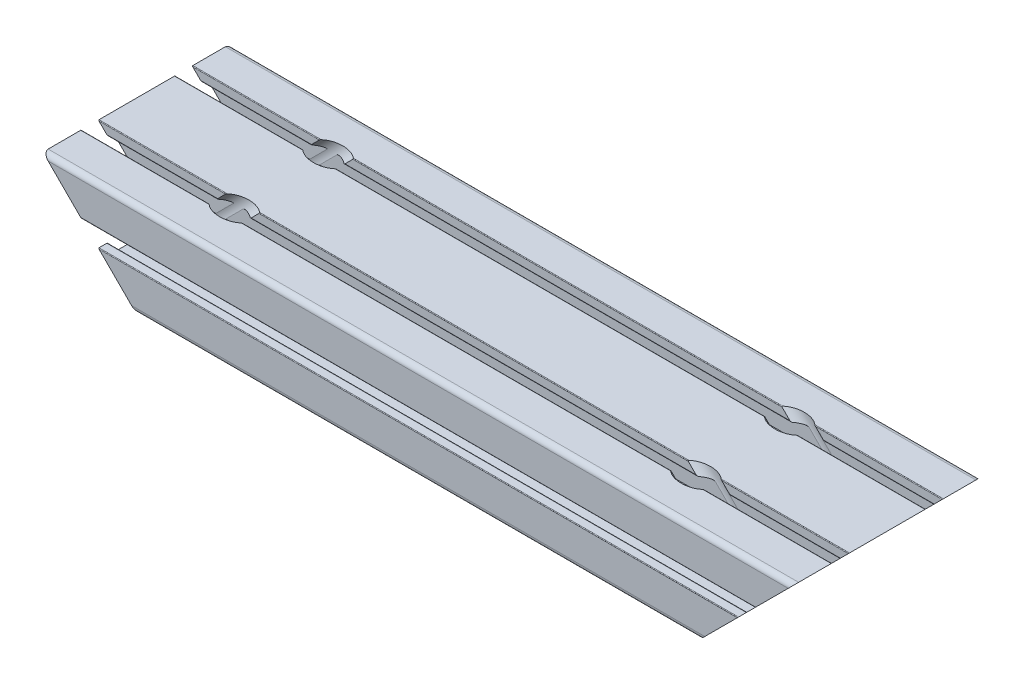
SolidWorks part; units mm, degrees
ref_plane "Front Plane" through (0, 0, 0) normal (0, 0, 1) x (1, 0, 0)
ref_plane "Top Plane" through (0, 0, 0) normal (0, 1, 0) x (1, 0, 0)
ref_plane "Right Plane" through (0, 0, 0) normal (1, 0, 0) x (0, 0, -1)
sketch3d "3DSketch2"
  line L0 (195, 0, 0) -> (-165, 0, 0)
  dimension "D1" = 360
  dimension "D2" = 195
other "45-sarja 1.0036 45X90(1)"
ref_plane "Plane1" through (195, 0, 0) normal (-1, 0, 0) x (0, 1, 0)
sketch "Model" plane through (195, 0, 0) normal (-1, 0, 0) x (0, 1, 0)
  line L0 (4.3841, 25.8941) -> (3.3941, 26.8841)
  line L1 (2.9698, 26.8841) -> (1.9491, 25.8633)
  line L2 (-1.9491, 25.8633) -> (-2.9698, 26.8841)
  line L3 (-3.3941, 26.8841) -> (-4.3841, 25.8941)
  line L4 (-4.3841, 25.4698) -> (-3.3633, 24.4491)
  line L5 (-3.3633, 20.5509) -> (-4.3841, 19.5302)
  line L6 (-4.3841, 19.1059) -> (-3.3941, 18.1159)
  line L7 (-2.9698, 18.1159) -> (-1.9491, 19.1367)
  line L8 (1.9491, 19.1367) -> (2.9698, 18.1159)
  line L9 (3.3941, 18.1159) -> (4.3841, 19.1059)
  line L10 (4.3841, 19.5302) -> (3.3633, 20.5509)
  line L11 (3.3633, 24.4491) -> (4.3841, 25.4698)
  line L12 (-19.5, 12.5) -> (-19.5, -12.5)
  line L13 (-18.5, -13.5) -> (18.5, -13.5)
  line L14 (19.5, -12.5) -> (19.5, 12.5)
  line L15 (18.5, 13.5) -> (-18.5, 13.5)
  line L16 (3.3633, -20.5509) -> (4.3841, -19.5302)
  line L17 (4.3841, -19.1059) -> (3.3941, -18.1159)
  line L18 (2.9698, -18.1159) -> (1.9491, -19.1367)
  line L19 (-1.9491, -19.1367) -> (-2.9698, -18.1159)
  line L20 (-3.3941, -18.1159) -> (-4.3841, -19.1059)
  line L21 (-4.3841, -19.5302) -> (-3.3633, -20.5509)
  line L22 (-3.3633, -24.4491) -> (-4.3841, -25.4698)
  line L23 (-4.3841, -25.8941) -> (-3.3941, -26.8841)
  line L24 (-2.9698, -26.8841) -> (-1.9491, -25.8633)
  line L25 (1.9491, -25.8633) -> (2.9698, -26.8841)
  line L26 (3.3941, -26.8841) -> (4.3841, -25.8941)
  line L27 (4.3841, -25.4698) -> (3.3633, -24.4491)
  line L28 (4.4, -45) -> (20, -45)
  line L29 (4.1, -41) -> (4.1, -44.7)
  line L30 (6.5, -40.5) -> (4.6, -40.5)
  line L31 (6.8, -31.7) -> (6.8, -40.2)
  line L32 (4.8, -29.7) -> (6.8, -31.7)
  line L33 (-4.8, -29.7) -> (4.8, -29.7)
  line L34 (-6.8, -31.7) -> (-4.8, -29.7)
  line L35 (-6.8, -40.2) -> (-6.8, -31.7)
  line L36 (-4.6, -40.5) -> (-6.5, -40.5)
  line L37 (-4.1, -44.7) -> (-4.1, -41)
  line L38 (-20, -45) -> (-4.4, -45)
  line L39 (-22.5, -26.9) -> (-22.5, -42.5)
  line L40 (-18.5, -26.6) -> (-22.2, -26.6)
  line L41 (-18, -29) -> (-18, -27.1)
  line L42 (-9.2, -29.3) -> (-17.7, -29.3)
  line L43 (-7.2, -27.3) -> (-9.2, -29.3)
  line L44 (-7.2, -17.7) -> (-7.2, -27.3)
  line L45 (-9.2, -15.7) -> (-7.2, -17.7)
  line L46 (-17.7, -15.7) -> (-9.2, -15.7)
  line L47 (-18, -17.9) -> (-18, -16)
  line L48 (-22.2, -18.4) -> (-18.5, -18.4)
  line L49 (-22.5, 18.1) -> (-22.5, -18.1)
  line L50 (-18.5, 18.4) -> (-22.2, 18.4)
  line L51 (-18, 16) -> (-18, 17.9)
  line L52 (-9.2, 15.7) -> (-17.7, 15.7)
  line L53 (-7.2, 17.7) -> (-9.2, 15.7)
  line L54 (-7.2, 27.3) -> (-7.2, 17.7)
  line L55 (-9.2, 29.3) -> (-7.2, 27.3)
  line L56 (-17.7, 29.3) -> (-9.2, 29.3)
  line L57 (-18, 27.1) -> (-18, 29)
  line L58 (-22.2, 26.6) -> (-18.5, 26.6)
  line L59 (-22.5, 42.5) -> (-22.5, 26.9)
  line L60 (-4.4, 45) -> (-20, 45)
  line L61 (-4.1, 41) -> (-4.1, 44.7)
  line L62 (-6.5, 40.5) -> (-4.6, 40.5)
  line L63 (-6.8, 31.7) -> (-6.8, 40.2)
  line L64 (-4.8, 29.7) -> (-6.8, 31.7)
  line L65 (4.8, 29.7) -> (-4.8, 29.7)
  line L66 (6.8, 31.7) -> (4.8, 29.7)
  line L67 (6.8, 40.2) -> (6.8, 31.7)
  line L68 (4.6, 40.5) -> (6.5, 40.5)
  line L69 (4.1, 44.7) -> (4.1, 41)
  line L70 (20, 45) -> (4.4, 45)
  line L71 (22.5, 26.9) -> (22.5, 42.5)
  line L72 (18.5, 26.6) -> (22.2, 26.6)
  line L73 (18, 29) -> (18, 27.1)
  line L74 (9.2, 29.3) -> (17.7, 29.3)
  line L75 (7.2, 27.3) -> (9.2, 29.3)
  line L76 (7.2, 17.7) -> (7.2, 27.3)
  line L77 (9.2, 15.7) -> (7.2, 17.7)
  line L78 (17.7, 15.7) -> (9.2, 15.7)
  line L79 (18, 17.9) -> (18, 16)
  line L80 (22.2, 18.4) -> (18.5, 18.4)
  line L81 (22.5, -18.1) -> (22.5, 18.1)
  line L82 (18.5, -18.4) -> (22.2, -18.4)
  line L83 (18, -16) -> (18, -17.9)
  line L84 (9.2, -15.7) -> (17.7, -15.7)
  line L85 (7.2, -17.7) -> (9.2, -15.7)
  line L86 (7.2, -27.3) -> (7.2, -17.7)
  line L87 (9.2, -29.3) -> (7.2, -27.3)
  line L88 (17.7, -29.3) -> (9.2, -29.3)
  line L89 (18, -27.1) -> (18, -29)
  line L90 (22.2, -26.6) -> (18.5, -26.6)
  line L91 (22.5, -42.5) -> (22.5, -26.9)
  circle A0 centre (14.65, 37.15) radius 5.85
  arc A1 (4.3841, 25.4698) -> (4.3841, 25.8941) centre (4.1719, 25.682) ccw
  arc A2 (3.3941, 26.8841) -> (2.9698, 26.8841) centre (3.182, 26.6719) ccw
  arc A3 (1.6059, 25.8056) -> (1.9491, 25.8633) centre (1.7369, 26.0754) ccw
  arc A4 (1.6059, 25.8056) -> (-1.6059, 25.8056) centre (0, 22.5) ccw
  arc A5 (-1.9491, 25.8633) -> (-1.6059, 25.8056) centre (-1.7369, 26.0754) ccw
  arc A6 (-2.9698, 26.8841) -> (-3.3941, 26.8841) centre (-3.182, 26.6719) ccw
  arc A7 (-4.3841, 25.8941) -> (-4.3841, 25.4698) centre (-4.1719, 25.682) ccw
  arc A8 (-3.3056, 24.1059) -> (-3.3633, 24.4491) centre (-3.5754, 24.2369) ccw
  arc A9 (-3.3056, 24.1059) -> (-3.3056, 20.8941) centre (0, 22.5) ccw
  arc A10 (-3.3633, 20.5509) -> (-3.3056, 20.8941) centre (-3.5754, 20.7631) ccw
  arc A11 (-4.3841, 19.5302) -> (-4.3841, 19.1059) centre (-4.1719, 19.318) ccw
  arc A12 (-3.3941, 18.1159) -> (-2.9698, 18.1159) centre (-3.182, 18.3281) ccw
  arc A13 (-1.6059, 19.1944) -> (-1.9491, 19.1367) centre (-1.7369, 18.9246) ccw
  arc A14 (-1.6059, 19.1944) -> (1.6059, 19.1944) centre (0, 22.5) ccw
  arc A15 (1.9491, 19.1367) -> (1.6059, 19.1944) centre (1.7369, 18.9246) ccw
  arc A16 (2.9698, 18.1159) -> (3.3941, 18.1159) centre (3.182, 18.3281) ccw
  arc A17 (4.3841, 19.1059) -> (4.3841, 19.5302) centre (4.1719, 19.318) ccw
  arc A18 (3.3056, 20.8941) -> (3.3633, 20.5509) centre (3.5754, 20.7631) ccw
  arc A19 (3.3056, 20.8941) -> (3.3056, 24.1059) centre (0, 22.5) ccw
  arc A20 (3.3633, 24.4491) -> (3.3056, 24.1059) centre (3.5754, 24.2369) ccw
  arc A21 (-18.5, 13.5) -> (-19.5, 12.5) centre (-18.5, 12.5) ccw
  arc A22 (-19.5, -12.5) -> (-18.5, -13.5) centre (-18.5, -12.5) ccw
  arc A23 (18.5, -13.5) -> (19.5, -12.5) centre (18.5, -12.5) ccw
  arc A24 (19.5, 12.5) -> (18.5, 13.5) centre (18.5, 12.5) ccw
  arc A25 (4.3841, -19.5302) -> (4.3841, -19.1059) centre (4.1719, -19.318) ccw
  arc A26 (3.3941, -18.1159) -> (2.9698, -18.1159) centre (3.182, -18.3281) ccw
  arc A27 (1.6059, -19.1944) -> (1.9491, -19.1367) centre (1.7369, -18.9246) ccw
  arc A28 (1.6059, -19.1944) -> (-1.6059, -19.1944) centre (0, -22.5) ccw
  arc A29 (-1.9491, -19.1367) -> (-1.6059, -19.1944) centre (-1.7369, -18.9246) ccw
  arc A30 (-2.9698, -18.1159) -> (-3.3941, -18.1159) centre (-3.182, -18.3281) ccw
  arc A31 (-4.3841, -19.1059) -> (-4.3841, -19.5302) centre (-4.1719, -19.318) ccw
  arc A32 (-3.3056, -20.8941) -> (-3.3633, -20.5509) centre (-3.5754, -20.7631) ccw
  arc A33 (-3.3056, -20.8941) -> (-3.3056, -24.1059) centre (0, -22.5) ccw
  arc A34 (-3.3633, -24.4491) -> (-3.3056, -24.1059) centre (-3.5754, -24.2369) ccw
  arc A35 (-4.3841, -25.4698) -> (-4.3841, -25.8941) centre (-4.1719, -25.682) ccw
  arc A36 (-3.3941, -26.8841) -> (-2.9698, -26.8841) centre (-3.182, -26.6719) ccw
  arc A37 (-1.6059, -25.8056) -> (-1.9491, -25.8633) centre (-1.7369, -26.0754) ccw
  arc A38 (-1.6059, -25.8056) -> (1.6059, -25.8056) centre (0, -22.5) ccw
  arc A39 (1.9491, -25.8633) -> (1.6059, -25.8056) centre (1.7369, -26.0754) ccw
  arc A40 (2.9698, -26.8841) -> (3.3941, -26.8841) centre (3.182, -26.6719) ccw
  arc A41 (4.3841, -25.8941) -> (4.3841, -25.4698) centre (4.1719, -25.682) ccw
  arc A42 (3.3056, -24.1059) -> (3.3633, -24.4491) centre (3.5754, -24.2369) ccw
  arc A43 (3.3056, -24.1059) -> (3.3056, -20.8941) centre (0, -22.5) ccw
  arc A44 (3.3633, -20.5509) -> (3.3056, -20.8941) centre (3.5754, -20.7631) ccw
  circle A45 centre (14.65, -37.15) radius 5.85
  arc A46 (4.1, -44.7) -> (4.4, -45) centre (4.4, -44.7) ccw
  arc A47 (4.6, -40.5) -> (4.1, -41) centre (4.6, -41) ccw
  arc A48 (6.5, -40.5) -> (6.8, -40.2) centre (6.5, -40.2) ccw
  arc A49 (-6.8, -40.2) -> (-6.5, -40.5) centre (-6.5, -40.2) ccw
  arc A50 (-4.1, -41) -> (-4.6, -40.5) centre (-4.6, -41) ccw
  arc A51 (-4.4, -45) -> (-4.1, -44.7) centre (-4.4, -44.7) ccw
  arc A52 (-22.5, -42.5) -> (-20, -45) centre (-20, -42.5) ccw
  arc A53 (-22.2, -26.6) -> (-22.5, -26.9) centre (-22.2, -26.9) ccw
  arc A54 (-18, -27.1) -> (-18.5, -26.6) centre (-18.5, -27.1) ccw
  arc A55 (-18, -29) -> (-17.7, -29.3) centre (-17.7, -29) ccw
  arc A56 (-17.7, -15.7) -> (-18, -16) centre (-17.7, -16) ccw
  arc A57 (-18.5, -18.4) -> (-18, -17.9) centre (-18.5, -17.9) ccw
  arc A58 (-22.5, -18.1) -> (-22.2, -18.4) centre (-22.2, -18.1) ccw
  arc A59 (-22.2, 18.4) -> (-22.5, 18.1) centre (-22.2, 18.1) ccw
  arc A60 (-18, 17.9) -> (-18.5, 18.4) centre (-18.5, 17.9) ccw
  arc A61 (-18, 16) -> (-17.7, 15.7) centre (-17.7, 16) ccw
  arc A62 (-17.7, 29.3) -> (-18, 29) centre (-17.7, 29) ccw
  arc A63 (-18.5, 26.6) -> (-18, 27.1) centre (-18.5, 27.1) ccw
  arc A64 (-22.5, 26.9) -> (-22.2, 26.6) centre (-22.2, 26.9) ccw
  arc A65 (-20, 45) -> (-22.5, 42.5) centre (-20, 42.5) ccw
  arc A66 (-4.1, 44.7) -> (-4.4, 45) centre (-4.4, 44.7) ccw
  arc A67 (-4.6, 40.5) -> (-4.1, 41) centre (-4.6, 41) ccw
  arc A68 (-6.5, 40.5) -> (-6.8, 40.2) centre (-6.5, 40.2) ccw
  arc A69 (6.8, 40.2) -> (6.5, 40.5) centre (6.5, 40.2) ccw
  arc A70 (4.1, 41) -> (4.6, 40.5) centre (4.6, 41) ccw
  arc A71 (4.4, 45) -> (4.1, 44.7) centre (4.4, 44.7) ccw
  arc A72 (22.5, 42.5) -> (20, 45) centre (20, 42.5) ccw
  arc A73 (22.2, 26.6) -> (22.5, 26.9) centre (22.2, 26.9) ccw
  arc A74 (18, 27.1) -> (18.5, 26.6) centre (18.5, 27.1) ccw
  arc A75 (18, 29) -> (17.7, 29.3) centre (17.7, 29) ccw
  arc A76 (17.7, 15.7) -> (18, 16) centre (17.7, 16) ccw
  arc A77 (18.5, 18.4) -> (18, 17.9) centre (18.5, 17.9) ccw
  arc A78 (22.5, 18.1) -> (22.2, 18.4) centre (22.2, 18.1) ccw
  arc A79 (22.2, -18.4) -> (22.5, -18.1) centre (22.2, -18.1) ccw
  arc A80 (18, -17.9) -> (18.5, -18.4) centre (18.5, -17.9) ccw
  arc A81 (18, -16) -> (17.7, -15.7) centre (17.7, -16) ccw
  arc A82 (17.7, -29.3) -> (18, -29) centre (17.7, -29) ccw
  arc A83 (18.5, -26.6) -> (18, -27.1) centre (18.5, -27.1) ccw
  arc A84 (22.5, -26.9) -> (22.2, -26.6) centre (22.2, -26.9) ccw
  arc A85 (20, -45) -> (22.5, -42.5) centre (20, -42.5) ccw
  circle A86 centre (-14.65, -37.15) radius 5.85
  circle A87 centre (-14.65, 37.15) radius 5.85
  point P262 (0, -22.5)
  point P263 (0, 22.5)
  point P264 (0, 0)
  point P265 (22.5, 0)
  point P266 (-22.5, 0)
  point P267 (-22.5, 45)
  point P268 (0, 45)
  point P269 (22.5, 45)
  point P270 (22.5, -45)
  point P271 (0, -45)
  point P272 (-22.5, -45)
  point P273 (0, 0)
ref_plane "Plane3" through (15, 0, 0) normal (-1, 0, 0) x (0, 0, 1)
sketch "Sketch2" plane through (0, 0, 45) normal (0, 0, 1) x (1, 0, 0)
  line L0 (195, 22.5) -> (150, -22.5)
  line L1 (-165, -22.5) -> (195, -22.5) construction
  line L2 (150, -22.5) -> (200.454, -30.7589)
  line L3 (200.454, -30.7589) -> (195, 22.5)
  line L4 (-165, 22.5) -> (-120, -22.5)
  line L5 (-120, -22.5) -> (-205.8254, -31.7583)
  line L6 (-205.8254, -31.7583) -> (-165, 22.5)
extrude "Cut-Extrude1" cut sketch "Sketch2" against normal through all
ref_plane "Plane2" through (45.9449, -45.9449, 0) normal (0.7071, -0.7071, 0) x (0, 0, -1)
sketch "Sketch5" plane through (45.9449, -45.9449, 0) normal (0.7071, -0.7071, 0) x (0, 0, -1)
  line L0 (-18.1, 153.7957) -> (18.1, 153.7957) construction
  line L1 (-45, -100.7627) -> (-45, 150.2602) construction
  line L2 (45, -100.7627) -> (45, 150.2602) construction
  point P8 (22.5, 104.7957)
  point P10 (-22.5, 104.7957)
  point P15 (0, 0)
  point P20 (-29.8699, 95.6517)
  point P21 (0, 0)
  dimension "D1" = 49
  dimension "D2" = 49
  dimension "D3" = 22.5
  dimension "D4" = 22.5
hole_wizard "CBORE for M8 Hex Head Bolt1" positions "Sketch5" profile "Sketch6" counterbore size "M8" standard "DIN"
sketch "Sketch6" plane through (120.0467, 28.1569, -22.5) normal (0, 0, 1) x (-0.7071, -0.7071, 0)
  line L0 (0, 0) -> (0, 88.8198)
  line L1 (0, 88.8198) -> (4.25, 88.8198)
  line L3 (4.25, 88.8198) -> (4.25, 40)
  line L4 (4.25, 40) -> (7, 40)
  line L5 (7, 40) -> (7, 0)
  line L7 (7, 0) -> (0, 0)
  line L11 (0, -6.35) -> (0, 107.95) construction
  dimension "Thru Hole Dia." = 8.5
  dimension "Thru Hole Depth" = 88.8198
  dimension "C'Bore Dia." = 14
  dimension "C'Bore Depth" = 40
mirror "Mirror3" about plane through (15, 0, 0) normal (-1, 0, 0) of "CBORE for M8 Hex Head Bolt1"
